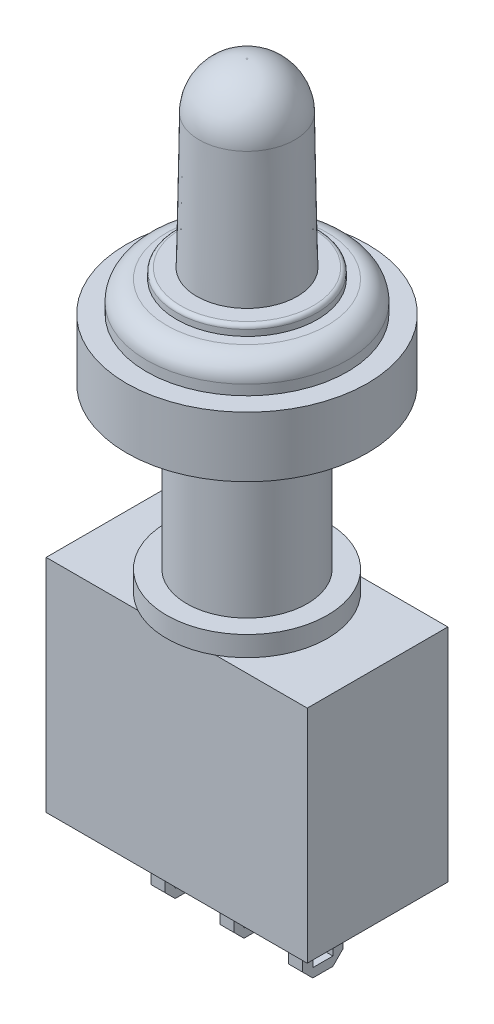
SolidWorks part; units mm, degrees
ref_plane "Plan1" through (0, 0, 0) normal (0, 0, 1) x (1, 0, 0)
ref_plane "Plan2" through (0, 0, 0) normal (0, 1, 0) x (1, 0, 0)
ref_plane "Plan3" through (0, 0, 0) normal (1, 0, 0) x (0, 0, -1)
sketch "Esquisse1" plane through (0, 0, 0) normal (0, 0, 1) x (1, 0, 0)
  line L1 (-40, 20) -> (-27, 20)
  line L2 (-40, 20) -> (-40, 9)
  line L3 (-40, 9) -> (-27, 9)
  line L4 (-27, 20) -> (-27, 9)
  dimension "D1" = 13
  dimension "D2" = 11
extrude "Base-Extrusion" add sketch "Esquisse1" along normal blind 7
sketch "Esquisse2" plane through (0, 20, 0) normal (0, 1, 0) x (-1, 0, 0)
  line L0 (27, 7) -> (40, 7) construction
  line L1 (27, 7) -> (27, 0) construction
  circle A0 centre (33.5, 3.5) radius 4
  dimension "D1" = 8
  dimension "D2" = 3.5
  dimension "D3" = 6.5
extrude "Boss.-Extru.1" add sketch "Esquisse2" along normal blind 1
sketch "Esquisse3" plane through (0, 21, 0) normal (0, 1, 0) x (-1, 0, 0)
  circle A0 centre (33.5, 3.5) radius 3
  dimension "D1" = 6
extrude "Boss.-Extru.2" add sketch "Esquisse3" along normal blind 8
sketch "Esquisse4" plane through (0, 29, 0) normal (0, 1, 0) x (-1, 0, 0)
  circle A0 centre (33.5, 3.5) radius 6
  dimension "D1" = 12
extrude "Boss.-Extru.4" add sketch "Esquisse4" along normal blind 3
sketch "Esquisse6" plane through (0, 32, 0) normal (0, 1, 0) x (-1, 0, 0)
  circle A0 centre (33.5, 3.5) radius 5
  dimension "D1" = 10
extrude "Boss.-Extru.5" add sketch "Esquisse6" along normal blind 1.5
fillet "Congé2" radius 1
sketch "Esquisse7" plane through (0, 33.5, 0) normal (0, 1, 0) x (-1, 0, 0)
  circle A0 centre (33.5, 3.5) radius 3.5
  dimension "D1" = 7
extrude "Boss.-Extru.6" add sketch "Esquisse7" along normal blind 0.5
fillet "Congé3" radius 0.2
sketch "Esquisse8" plane through (0, 34, 0) normal (0, 1, 0) x (-1, 0, 0)
  circle A0 centre (33.5, 3.5) radius 2.5
  dimension "D1" = 5
extrude "Boss.-Extru.7" add sketch "Esquisse8" along normal blind 9 draft 1
fillet "Congé4" radius 2.35
sketch "Esquisse10" plane through (0, 9, 0) normal (0, -1, 0) x (1, 0, 0)
  line L1 (-37.275, 4.5) -> (-36.575, 4.5)
  line L2 (-37.275, 4.5) -> (-37.275, 2.5)
  line L3 (-37.275, 2.5) -> (-36.575, 2.5)
  line L4 (-36.575, 4.5) -> (-36.575, 2.5)
  line L7 (-33.85, 4.5) -> (-33.15, 4.5)
  line L8 (-33.85, 4.5) -> (-33.85, 2.5)
  line L9 (-33.85, 2.5) -> (-33.15, 2.5)
  line L10 (-33.15, 4.5) -> (-33.15, 2.5)
  line L11 (-30.425, 4.5) -> (-29.725, 4.5)
  line L12 (-30.425, 4.5) -> (-30.425, 2.5)
  line L13 (-30.425, 2.5) -> (-29.725, 2.5)
  line L14 (-29.725, 4.5) -> (-29.725, 2.5)
extrude "Boss.-Extru.8" add sketch "Esquisse10" along normal blind 3.5
sketch "Esquisse11" plane through (-29.725, 0, 0) normal (1, 0, 0) x (0, 0, -1)
  line L1 (-3, 8.4251) -> (-4, 8.4251)
  line L2 (-3, 8.4251) -> (-3, 5.9467)
  line L3 (-3, 5.9467) -> (-4, 5.9467)
  line L4 (-4, 8.4251) -> (-4, 5.9467)
extrude "Enlèv. mat.-Extru.1" cut sketch "Esquisse11" against normal through all
chamfer "Chanfrein1" distance 0.5 angle 45
